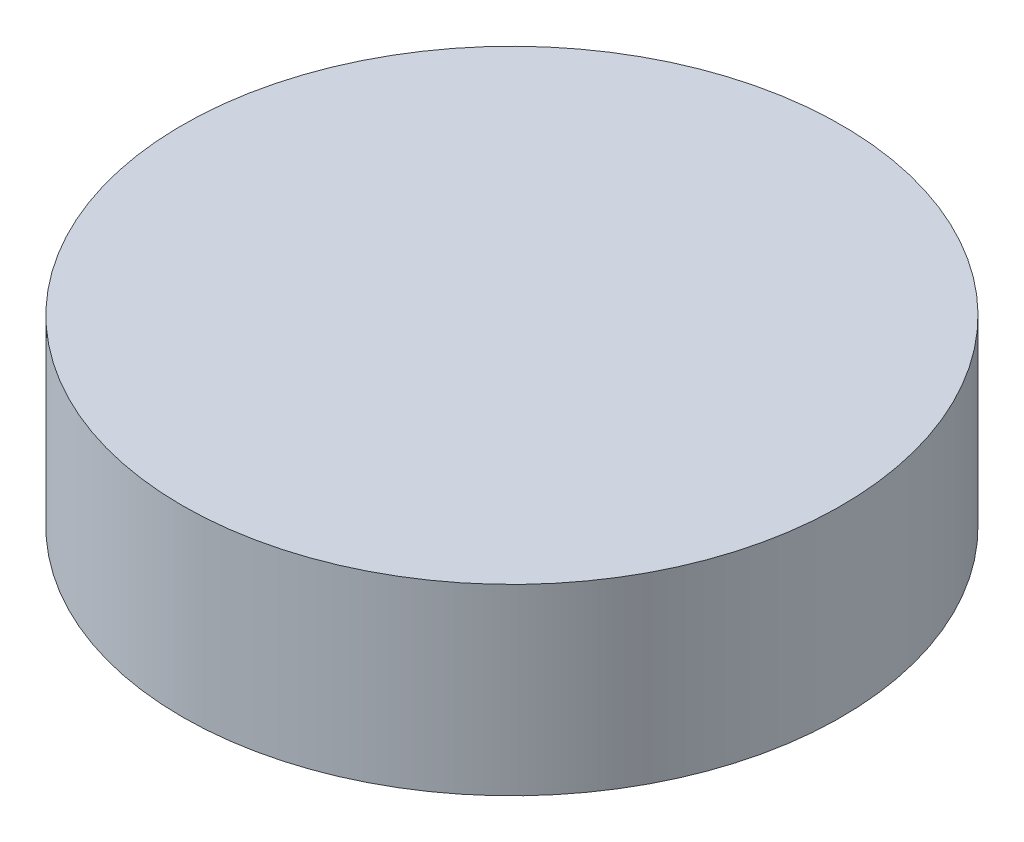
SolidWorks part; units mm, degrees
ref_plane "Front Plane" through (0, 0, 0) normal (0, 0, 1) x (1, 0, 0)
ref_plane "Top Plane" through (0, 0, 0) normal (0, 1, 0) x (1, 0, 0)
ref_plane "Right Plane" through (0, 0, 0) normal (1, 0, 0) x (0, 0, -1)
sketch "Sketch1" plane through (0, 0, 0) normal (1, 0, 0) x (0, 0, -1)
  line L0 (0, 4.9886) -> (0, 0) construction
  line L1 (-10.2, -1.5114) -> (-11.7, -1.5114)
  line L2 (0, 3.4886) -> (0, 4.9886)
  line L3 (0, 4.9886) -> (-11.7, 4.9886)
  line L4 (-11.7, -1.5114) -> (-11.7, 4.9886)
  line L7 (0, 3.4886) -> (-10.2, 3.4886)
  line L8 (-10.2, -1.5114) -> (-10.2, 3.4886)
  dimension "D1" = 10.2
  dimension "D2" = 5
  dimension "D3" = 1.5
revolve "Revolve1" add sketch "Sketch1" angle 360 about L0
thread "Thread1" pitch 1.25 start angle 0, offset 3, length 0, pitch 1.5, diameter 20.6
ref_plane "Plane1" through (10.3, -4.5114, 0) normal (0, 0, 1) x (1, 0, 0)
sketch "Thread Profile1" plane through (10.3, -4.5114, 0) normal (0, 0, 1) x (1, 0, 0)
  line L0 (0, 0) -> (0, 1.25) construction
  line L11 (0, 0) -> (0, 1.0937)
  line L12 (0, 1.0937) -> (-0.6766, 0.7031)
  line L13 (-0.6766, 0.7031) -> (-0.6766, 0.3906)
  line L15 (-0.6766, 0.3906) -> (0, 0)
  line L17 (-0.6766, 0.5469) -> (0, 0.5469) construction
  point P2 (0, 0)
  dimension "Pitch" = 1.25
  dimension "Profile_Angle" = 60
  dimension "Profile_Land" = 0.3125
  dimension "Profile_Height" = 0.6766
sketch "Sketch4" plane through (0, -1.5114, 0) normal (0, -1, 0) x (1, 0, 0)
  circle A0 centre (0, 0) radius 11.8
extrude "Cut-Extrude1" cut sketch "Sketch4" along normal blind 20
